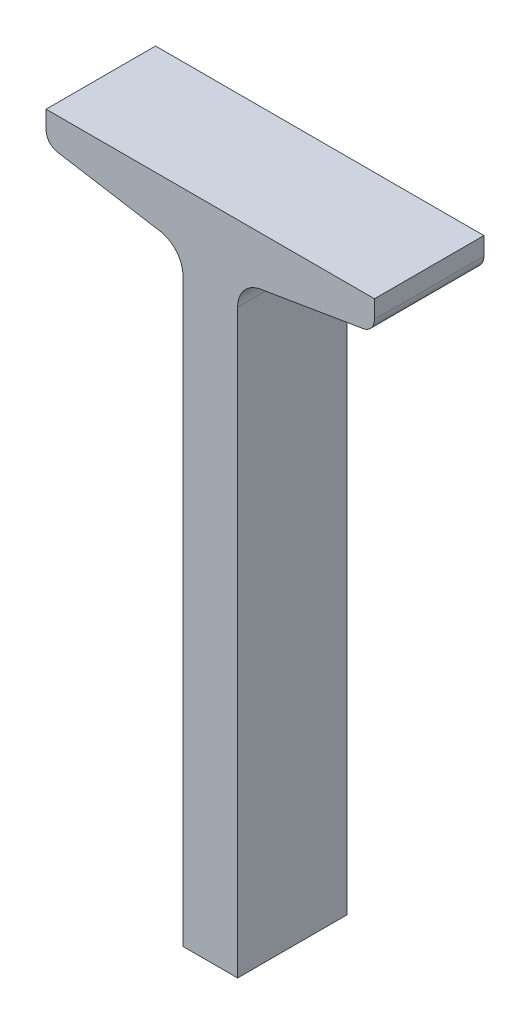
SolidWorks part; units mm, degrees
ref_plane "Plane1" through (0, 0, 0) normal (0, 0, 1) x (1, 0, 0)
ref_plane "Plane2" through (0, 0, 0) normal (0, 1, 0) x (-1, 0, 0)
ref_plane "Plane3" through (0, 0, 0) normal (1, 0, 0) x (0, 0, -1)
other "Configuration Table"
sketch "Sketch1"
extrude "BaseStee" add sketch "Sketch1" along normal mid plane 25.4
fillet "ToeFillet" radius 3.175 2 edges at (0, -6.879, 0) (76.2, -6.879, 0)
equation "\"delta@Sketch1\" =  (  ( \"BF@Sketch1\" / 2  ) -  ( \"TW@Sketch1\" / 2  ) ) "
equation "\"D1@Sketch1\" = \"DEPTH@Sketch1\" - \"TF@Sketch1\" -  ( \"RI@Sketch1\" * cos ( \"D2@Sketch1\" / 180 * 3.141592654 )  )  -  (  (  (  ( \"BF@Sketch1\" / 2 - \"TW@Sketch1\" / 2 )  / 2 )  -  ( \"RI@Sketch1\" - \"RI@Sketc"
